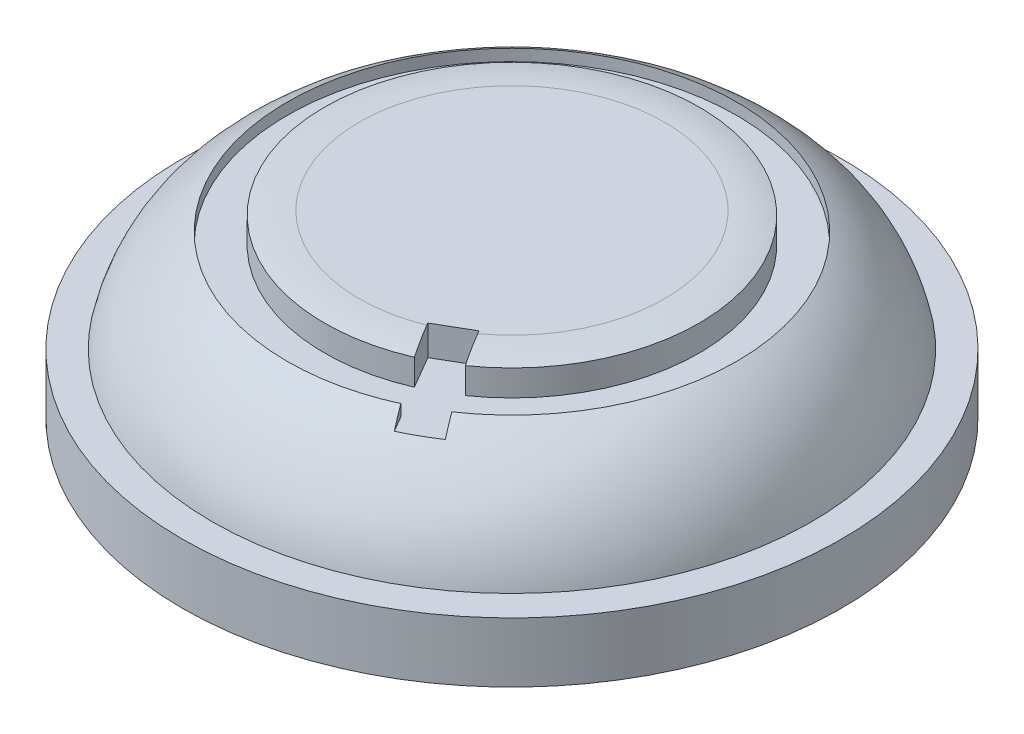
SolidWorks part; units mm, degrees
ref_plane "Front Plane" through (0, 0, 0) normal (0, 0, 1) x (1, 0, 0)
ref_plane "Top Plane" through (0, 0, 0) normal (0, 1, 0) x (1, 0, 0)
ref_plane "Right Plane" through (0, 0, 0) normal (1, 0, 0) x (0, 0, -1)
sketch "Sketch1" plane through (0, 0, 0) normal (0, 0, 1) x (1, 0, 0)
  line L0 (0, 8.274) -> (0, -6.744) construction
  line L10 (0, 0) -> (-5.101, 0)
  line L11 (-10, -4) -> (-11, -4)
  line L12 (-11, -4) -> (-11, -6)
  line L13 (-11, -6) -> (-10, -6)
  line L14 (-10, -6) -> (-10, -4.5)
  line L15 (-10, -4.5) -> (0, -4.5)
  line L16 (0, -4.5) -> (0, 0)
  arc A1 (-5.101, 0) -> (-10, -4) centre (-5.101, -5) ccw
  dimension "D5" = 5
  dimension "D1" = 4
  dimension "D2" = 2
  dimension "D3" = 1
  dimension "D4" = 1.5
  dimension "D6" = 10
revolve "Revolve2" add sketch "Sketch1" angle 360 about L0
sketch "Sketch2" plane through (0, 0, 0) normal (0, 1, 0) x (1, 0, 0)
  line L0 (1.8499, -4.6573) -> (2.48, -5.7369)
  line L1 (3.7074, -7.8398) -> (4.787, -7.2097)
  line L2 (4.787, -7.2097) -> (4.204, -6.211)
  line L3 (2.9295, -4.0272) -> (1.8499, -4.6573)
  line L4 (3.1139, -6.823) -> (3.7074, -7.8398)
  line L5 (3.5722, -5.1285) -> (2.9295, -4.0272)
  arc A0 (4.204, -6.211) -> (3.1139, -6.823) centre (0, 0) ccw
  arc A1 (3.5722, -5.1285) -> (2.48, -5.7369) centre (0, 0) ccw
  dimension "D1" = 1.25
  dimension "D2" = 7.5
  dimension "D3" = 1.25
  dimension "D4" = 1.25
  dimension "D5" = 0.5
extrude "Cut-Extrude1" cut sketch "Sketch2" against normal blind 1
